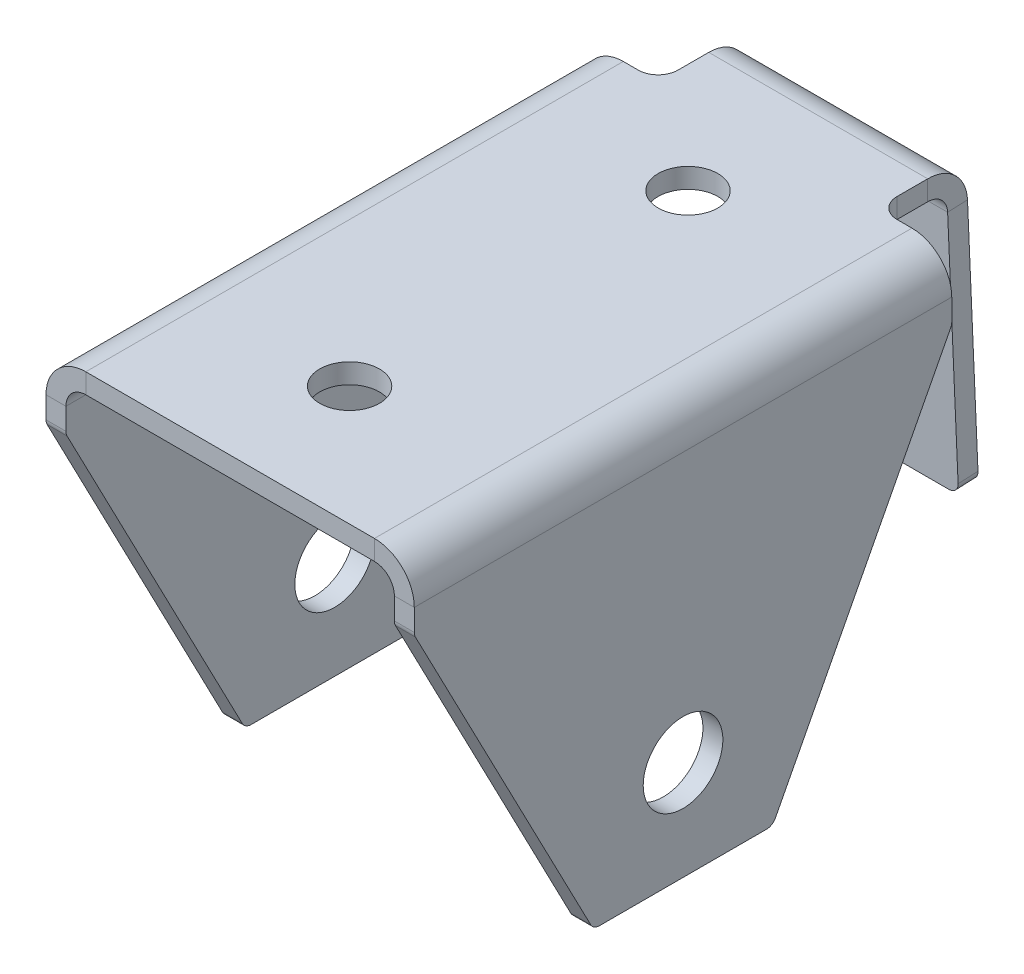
SolidWorks part; units mm, degrees
ref_plane "Plan de face" through (0, 0, 0) normal (0, 0, 1) x (1, 0, 0)
ref_plane "Plan de dessus" through (0, 0, 0) normal (0, 1, 0) x (1, 0, 0)
ref_plane "Plan de droite" through (0, 0, 0) normal (1, 0, 0) x (0, 0, -1)
sketch "Esquisse1" plane through (0, 0, 0) normal (0, 0, 1) x (1, 0, 0)
  line L0 (0, 67.5496) -> (0, -75.9528) construction
  line L1 (-18.5, -10) -> (-16.5, -10)
  line L2 (-16.5, -10) -> (-16.5, 29)
  line L3 (-16.5, 29) -> (0, 29)
  line L4 (0, 29) -> (0, 31)
  line L5 (0, 31) -> (-18.5, 31)
  line L6 (-18.5, 31) -> (-18.5, -10)
  line L7 (-16.5, 11) -> (-16.5, -11) construction
  dimension "D1" = 2
  dimension "D2" = 2
  dimension "D3" = 41
  dimension "D5" = 10
extrude "Extrusion1" add sketch "Esquisse1" along normal mid plane 54
sketch "Esquisse2" plane through (-18.5, 0, 0) normal (-1, 0, 0) x (0, 0, 1)
  line L0 (9, -10) -> (27, 24.5777)
  line L1 (27, -10) -> (-27, -10) construction
  line L3 (-9, -10) -> (-27, 24.5777)
  line L5 (-27, 24.5777) -> (-27, -10)
  line L6 (-27, -10) -> (-9, -10)
  line L7 (9, -10) -> (27, -10)
  line L8 (27, -10) -> (27, 24.5777)
  line L9 (0, 32.2243) -> (0, -12.6124) construction
  dimension "D1" = 55
  dimension "D2" = 18
extrude "Enlèv. mat.-Extru.1" cut sketch "Esquisse2" against normal through all
sketch "Esquisse3" plane through (-18.5, 0, 0) normal (-1, 0, 0) x (0, 0, 1)
  circle A0 centre (0, 0) radius 4
  dimension "D1" = 8
extrude "Enlèv. mat.-Extru.2" cut sketch "Esquisse3" against normal up to next
sketch "Esquisse4" plane through (0, 0, 0) normal (1, 0, 0) x (0, 0, -1)
  line L0 (27, 31) -> (35.9146, 31)
  line L1 (35.9146, 31) -> (37.1795, 2.0276)
  line L2 (37.1795, 2.0276) -> (35.1814, 1.9404)
  line L3 (35.1814, 1.9404) -> (34, 29)
  line L4 (34, 29) -> (27, 29)
  line L5 (27, 29) -> (27, 31)
  line L6 (9, -10) -> (27, 24.5777) construction
  dimension "D1" = 2
  dimension "D2" = 30
  dimension "D3" = 7
  dimension "D4" = 29
extrude "Extrusion2" add sketch "Esquisse4" against normal blind 11
fillet "Congé3" radius 1 5 edges at (-17.5, -10, -9) (-17.5, 24.5777, -27) (-17.5, -10, 9) (-17.5, 24.5777, 27) (-11, 1.984, -36.1805)
mirror "Symétrie1" about plane through (0, 0, 0) normal (1, 0, 0) of "Congé3", "Extrusion2", "Enlèv. mat.-Extru.2", "Enlèv. mat.-Extru.1", "Extrusion1"
sketch "Esquisse5" plane through (0, 31, 0) normal (0, 1, 0) x (-1, 0, 0)
  line L0 (0, 29.3913) -> (0, -41.4923) construction
  line L1 (-18.5, 27) -> (18.5, 27) construction
  circle A0 centre (0, 15) radius 3
  circle A1 centre (0, -19) radius 3
  dimension "D1" = 6
  dimension "D3" = 34
  dimension "D2" = 12
extrude "Enlèv. mat.-Extru.3" cut sketch "Esquisse5" against normal up to next
fillet "Congé4" radius 2 2 edges at (11, 30, -27)
sheet metal parameters "Tôlerie 1" parameters "D1"=2
bend "Pli dans angle3" bend angle 90 parameters "D1"=0, "D5"=1
flatten bends "Dépliage 1" parameters "D1"=0
sketch "Esquisse-Angle1" plane through (0, 31, 0) normal (0, 1, 0) x (-1, 0, 0)
  line L0 (16.8562, 27) -> (16.8562, -27) construction
  line L1 (11, -34.3762) -> (-11, -34.3762) construction
  line L2 (-16.8562, -27) -> (-16.8562, 27) construction
bend "Pli dans angle1" bend angle 90 parameters "D1"=0, "D5"=3
bend "Pli dans angle2" bend angle 87.5 parameters "D1"=0, "D5"=2
process bends "Pliage 1" parameters "D1"=0
sketch "Esquisse-Plate1" plane through (0, 31, 0) normal (0, 1, 0) x (-1, 0, 0)
flat pattern "Etat déplié1"
sketch "Lignes de pliage1" plane through (0, 31, 0) normal (0, 1, 0) x (-1, 0, 0)
  line L0 (-16.8562, -27) -> (-16.8562, 27) construction
  line L1 (11, -34.3762) -> (-11, -34.3762) construction
  line L2 (16.8562, 27) -> (16.8562, -27) construction
  line L3 (-16.8562, -27) -> (-16.8562, 27) construction
  line L4 (11, -34.3762) -> (-11, -34.3762) construction
  line L5 (16.8562, 27) -> (16.8562, -27) construction
bend of the flat pattern "Dépliage-<Pli dans angle1>1"
bend of the flat pattern "Dépliage-<Pli dans angle2>1"
bend of the flat pattern "Dépliage-<Pli dans angle3>1"
